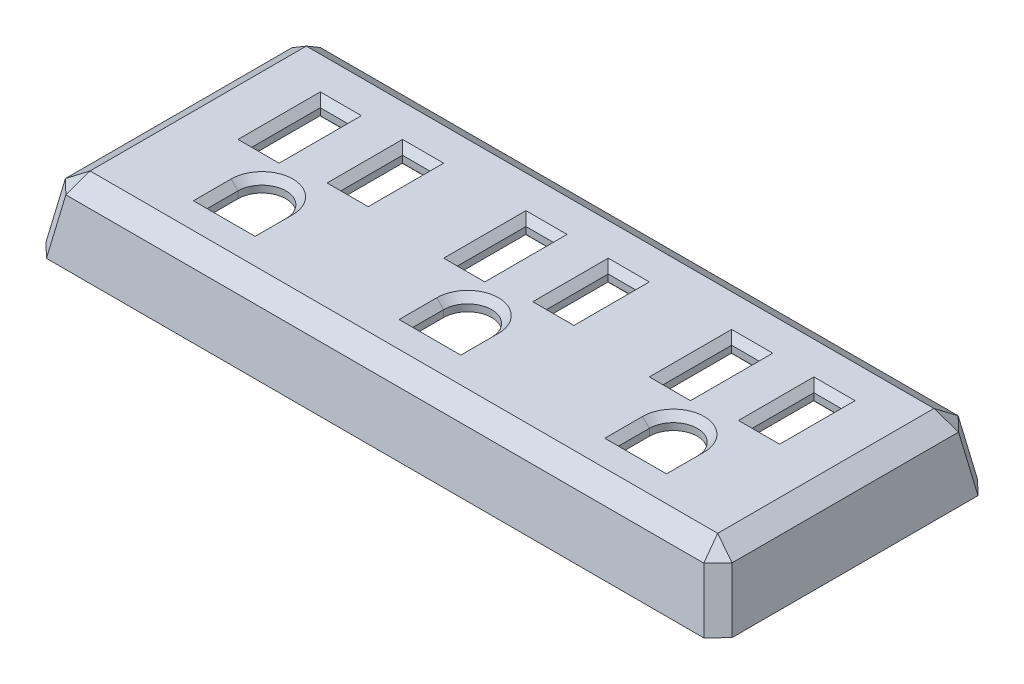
SolidWorks part; units mm, degrees
ref_plane "Front" through (0, 0, 0) normal (0, 0, 1) x (1, 0, 0)
ref_plane "Top" through (0, 0, 0) normal (0, 1, 0) x (1, 0, 0)
ref_plane "Right" through (0, 0, 0) normal (1, 0, 0) x (0, 0, -1)
sketch "Sketch2" plane through (0, 0, 0) normal (0, 1, 0) x (1, 0, 0)
  line L0 (50, -20) -> (-50, 20) construction
  line L1 (-50, -20) -> (50, -20)
  line L2 (-50, -20) -> (-50, 20)
  line L3 (-50, 20) -> (50, 20)
  line L4 (50, -20) -> (50, 20)
  dimension "D1" = 100
  dimension "D2" = 40
extrude "Extrude1" add sketch "Sketch2" along normal blind 10 draft 10
chamfer "Chamfer1" distance 2 angle 45 8 edges at (0, 10, -18.2367) (48.2367, 10, 0) (0, 10, 18.2367) (-48.2367, 10, 0) (-49.1184, 5, -19.1184) (49.1184, 5, -19.1184) (49.1184, 5, 19.1184) (-49.1184, 5, 19.1184)
shell "Shell1" thickness 2
sketch "Sketch22" plane through (-3.352, 10, 15.9706) normal (0, 1, 0) x (1, 0, 0)
  line L0 (-0.616, 25.9706) -> (7.384, 25.9706) construction
  line L1 (-4.616, 25.9706) -> (-0.616, 25.9706)
  line L2 (-4.616, 25.9706) -> (-4.616, 15.9706)
  line L3 (-4.616, 15.9706) -> (-0.616, 15.9706)
  line L4 (-0.616, 25.9706) -> (-0.616, 15.9706)
  line L5 (7.384, 25.9706) -> (11.384, 25.9706)
  line L6 (7.384, 25.9706) -> (7.384, 16.9706)
  line L7 (7.384, 16.9706) -> (11.384, 16.9706)
  line L8 (11.384, 25.9706) -> (11.384, 16.9706)
  line L9 (3.384, -4.0294) -> (3.384, 25.9706) construction
  line L10 (-0.116, 4.9706) -> (6.884, 4.9706)
  line L11 (6.884, 4.9706) -> (6.884, 9.4706)
  line L12 (-0.116, 4.9706) -> (-0.116, 9.4706)
  line L15 (-44.554, -4.0294) -> (51.322, -4.0294) construction
  arc A0 (6.884, 9.4706) -> (-0.116, 9.4706) centre (3.384, 9.4706) ccw
  dimension "D7" = 8
  dimension "D1" = 8
  dimension "D2" = 4
  dimension "D3" = 10
  dimension "D4" = 9
  dimension "D5" = 11
  dimension "D6" = 7
  dimension "D8" = 30
extrude "Cut-Extrude1" cut sketch "Sketch22" against normal through all
chamfer "Chamfer12" distance 1 angle 45 12 edges at (-3.468, 10, 8.75) (0.032, 10, 11) (3.532, 10, 8.75) (0.032, 10, 3) (8.032, 10, -5.5) (6.032, 10, -10) (4.032, 10, -5.5) (6.032, 10, -1) (-3.968, 10, -5) (-5.968, 10, -10) (-7.968, 10, -5) (-5.968, 10, 0)
other "3_Prong_Plug2"
pattern_linear "LPattern1" count 2 spacing 30 along (1, 0, 0) count 2 spacing 30 along (-1, 0, 0) of "Cut-Extrude1", "Chamfer12"
